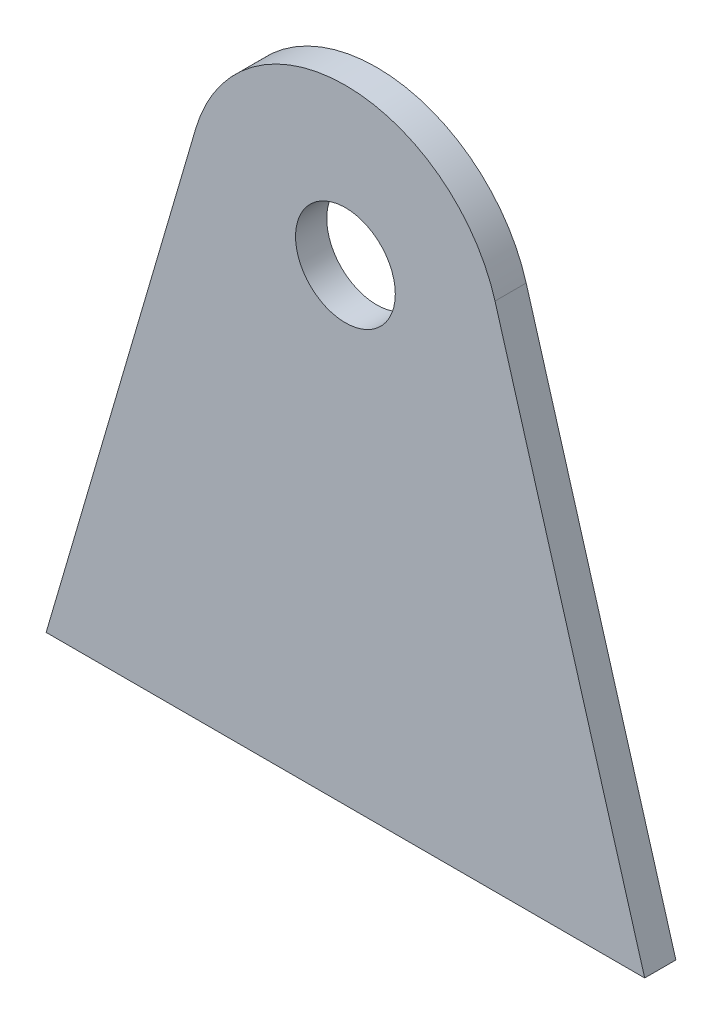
SolidWorks part; units mm, degrees
ref_plane "Plan de face" through (0, 0, 0) normal (0, 0, 1) x (1, 0, 0)
ref_plane "Plan de dessus" through (0, 0, 0) normal (0, 1, 0) x (1, 0, 0)
ref_plane "Plan de droite" through (0, 0, 0) normal (1, 0, 0) x (0, 0, -1)
sketch "Esquisse1" plane through (0, 0, 0) normal (0, 0, 1) x (1, 0, 0)
  line L0 (-48, 0) -> (48, 0)
  line L1 (-48, 0) -> (-23.9934, 82.0225)
  line L2 (48, 0) -> (23.9934, 82.0225)
  circle A0 centre (0, 75) radius 8
  arc A3 (23.9934, 82.0225) -> (-23.9934, 82.0225) centre (0, 75) ccw
  point P5 (-46.1484, 106.0596)
  point P8 (-20.3423, 60.4676)
  point P10 (17.8228, 57.4687)
  dimension "D5" = 16
  dimension "D1" = 96
  dimension "D2" = 48
  dimension "D3" = 75
extrude "Extrusion1" add sketch "Esquisse1" along normal blind 5
